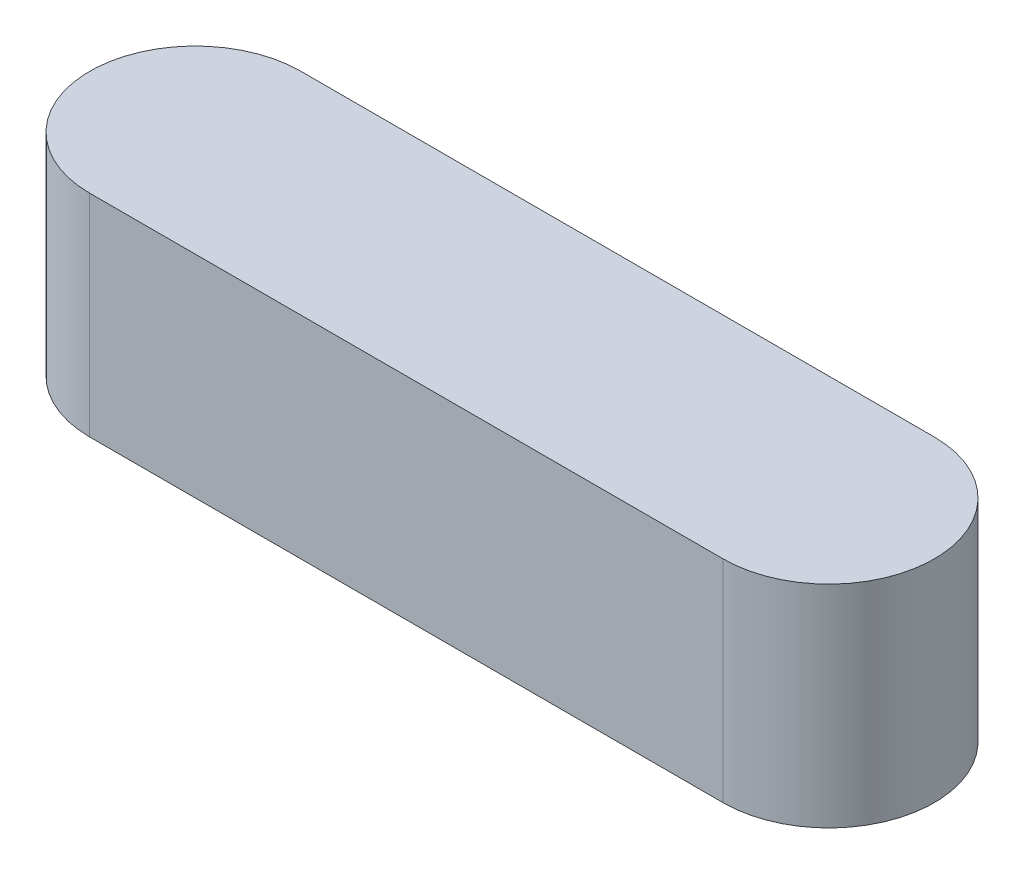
SolidWorks part; units mm, degrees
ref_plane "Front Plane" through (0, 0, 0) normal (0, 0, 1) x (1, 0, 0)
ref_plane "Top Plane" through (0, 0, 0) normal (0, 1, 0) x (1, 0, 0)
ref_plane "Right Plane" through (0, 0, 0) normal (1, 0, 0) x (0, 0, -1)
sketch "Sketch1" plane through (0, 0, 0) normal (0, 1, 0) x (1, 0, 0)
  line L0 (0, 0) -> (15, 0)
  line L1 (15, 5) -> (0, 5)
  arc A0 (15, 0) -> (15, 5) centre (15, 2.5) ccw
  arc A1 (0, 5) -> (0, 0) centre (0, 2.5) ccw
extrude "Boss-Extrude1" add sketch "Sketch1" along normal blind 5
equation "\"keywidth\" = 5mm"
equation "\"keyheigh\" = 5mm"
equation "\"facewidth\"= 20mm"
equation "\"D2@Sketch1\"= \"keywidth\""
equation "\"D1@Sketch1\"=\"facewidth\" -\"keywidth\""
equation "\"D1@Boss-Extrude1\"=\"keyheigh\""
